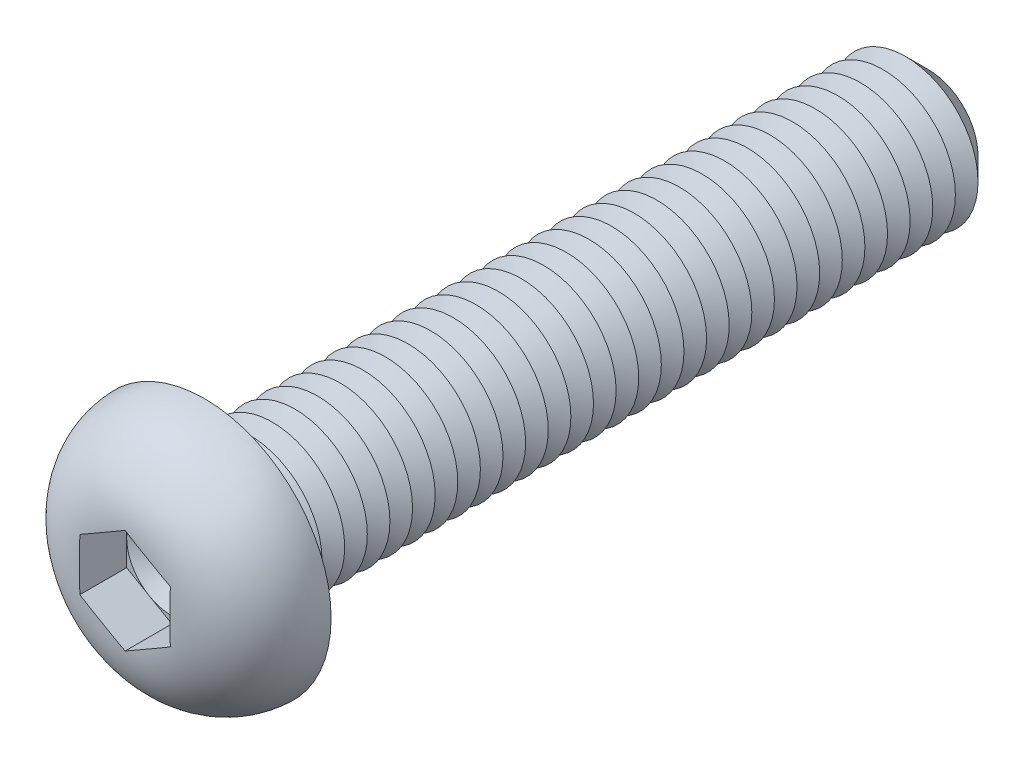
SolidWorks part; units mm, degrees
ref_plane "Front Plane" through (0, 0, 0) normal (0, 0, 1) x (1, 0, 0)
ref_plane "Top Plane" through (0, 0, 0) normal (0, 1, 0) x (1, 0, 0)
ref_plane "Right Plane" through (0, 0, 0) normal (1, 0, 0) x (0, 0, -1)
sketch "Sketch1" plane through (0, 0, 0) normal (1, 0, 0) x (0, 0, -1)
  line L0 (-47.9342, 0) -> (60.3146, 0) construction
sketch "Sketch2" plane through (0, 0, 0) normal (1, 0, 0) x (0, 0, -1)
  line L0 (0, 0) -> (-4.4, 0)
  line L1 (-47.9342, 0) -> (60.3146, 0) construction
  line L2 (-4.4, 0) -> (-4.4, 2.5011)
  line L3 (0, 7) -> (0, 0)
  arc A0 (-4.4, 2.5011) -> (0, 7) centre (0.1, 2.5011) cw
  dimension "D1" = 4.5
  dimension "D2" = 4.4
  dimension "D3" = 7
revolve "Revolve1" add sketch "Sketch2" angle 360 about L0
sketch "Sketch3" plane through (0, 0, 4.4) normal (0, 0, 1) x (1, 0, 0)
  line L1 (0, 2.8868) -> (-2.5, 1.4434)
  line L2 (-2.5, 1.4434) -> (-2.5, -1.4434)
  line L3 (-2.5, -1.4434) -> (0, -2.8868)
  line L4 (0, -2.8868) -> (2.5, -1.4434)
  line L5 (2.5, -1.4434) -> (2.5, 1.4434)
  line L6 (2.5, 1.4434) -> (0, 2.8868)
  circle A0 centre (0, 0) radius 2.5 construction
  dimension "D1" = 5
extrude "Cut-Extrude1" cut sketch "Sketch3" against normal blind 2.6
sketch "Sketch4" plane through (0, 0, 0) normal (0, 0, -1) x (-1, 0, 0)
  circle A0 centre (0, 0) radius 4
  dimension "D1" = 8
extrude "Boss-Extrude1" add sketch "Sketch4" along normal blind 40
chamfer "Chamfer1" distance 1.25 angle 45 1 edges at (-4, 0, -40)
sketch "Sketch5" plane through (0, 0, 0) normal (1, 0, 0) x (0, 0, -1)
  line L0 (1.25, 4) -> (2.5, 4)
  line L1 (38.75, 4) -> (0, 4) construction
  line L2 (2.5, 4) -> (1.875, 2.9175)
  line L3 (1.875, 2.9175) -> (1.25, 4)
  line L4 (0, -7) -> (0, 7) construction
  line L5 (38.75, 4) -> (0, 4) construction
  dimension "D1" = 1.25
  dimension "D2" = 1.25
revolve "Cut-Revolve1" cut sketch "Sketch5" angle 360 about L0
pattern_linear "LPattern1" count 30 spacing 1.25 along (0, 0, -1) of "Cut-Revolve1"
fillet "Fillet2" radius 0.5 1 edges at (4, 0, 0)
sketch "Sketch6" plane through (0, 0, 1.8) normal (0, 0, 1) x (1, 0, 0)
  line L0 (0, -2.8868) -> (2.5, -1.4434) construction
  circle A0 centre (0, 0) radius 2.5
extrude "Cut-Extrude2" cut sketch "Sketch6" against normal through all draft 60
